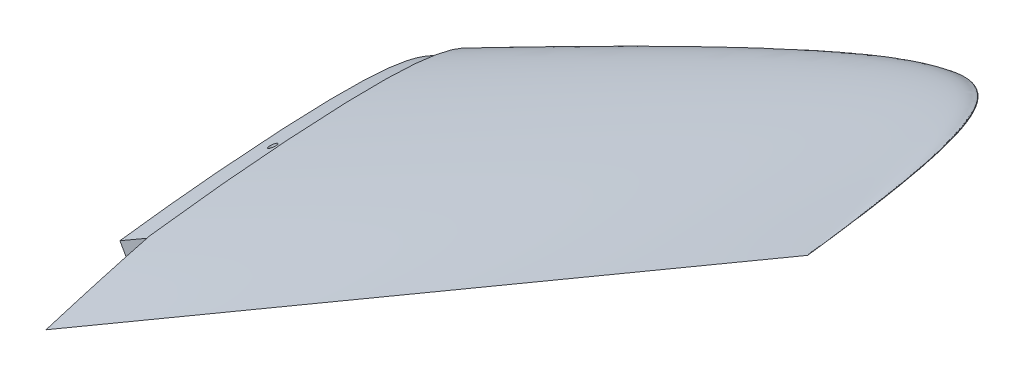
SolidWorks part; units mm, degrees
other "<X-UAV_CLOUDS_L_STABILIZER>-<Cut-Extrude2>"
ref_plane "Front Plane" through (0, 0, 0) normal (0, 0, 1) x (1, 0, 0)
ref_plane "Top Plane" through (0, 0, 0) normal (0, 1, 0) x (1, 0, 0)
ref_plane "Right Plane" through (0, 0, 0) normal (1, 0, 0) x (0, 0, -1)
mirrored part "X-UAV_CLOUDS_L_STABILIZER_Mirrored"
